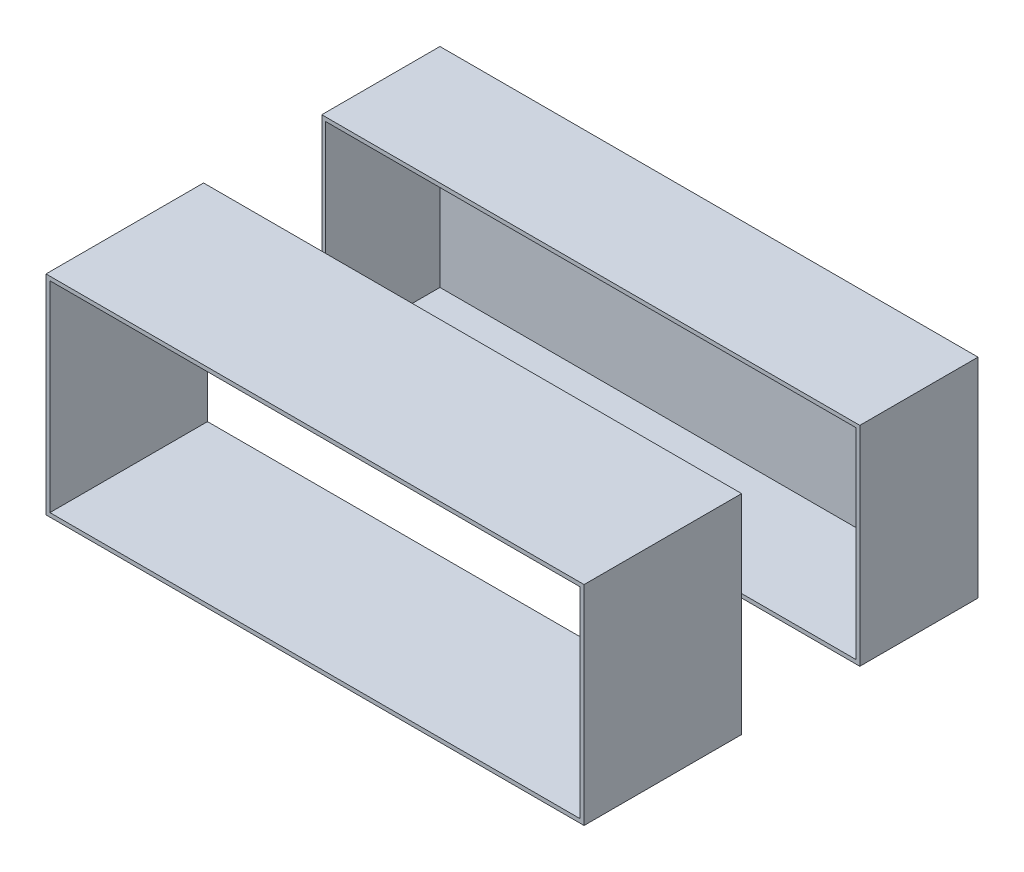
SolidWorks part; units mm, degrees
ref_plane "Ebene vorne" through (0, 0, 0) normal (0, 0, 1) x (1, 0, 0)
ref_plane "Ebene oben" through (0, 0, 0) normal (0, 1, 0) x (1, 0, 0)
ref_plane "Ebene rechts" through (0, 0, 0) normal (1, 0, 0) x (0, 0, -1)
sketch "Skizze1" plane through (0, 0, 0) normal (0, 0, 1) x (1, 0, 0)
  line L1 (0, 0) -> (682.9101, 0)
  line L2 (0, 0) -> (0, 264.8559)
  line L3 (0, 264.8559) -> (682.9101, 264.8559)
  line L4 (682.9101, 0) -> (682.9101, 264.8559)
extrude "Linear austragen1" add sketch "Skizze1" along normal blind 500
shell "Wandung1" thickness 5
ref_plane "Ebene1" through (0, 0, 150) normal (0, 0, 1) x (1, 0, 0)
ref_plane "Ebene2" through (0, 0, 300) normal (0, 0, 1) x (1, 0, 0)
split "Abspalten1" trim tools "Ebene2", "Ebene1" resulting bodies 107 108 109
delete or keep bodies "Körper-Löschen1" type delete bodies bodies 109
equation "\"LÄNGE\"=0"
equation "\"BREITE\"=0"
equation "\"HÖHE\"=0"
equation "\"DURCHMESSER\"=0"
equation "\"Stückzahl\"= 1"
